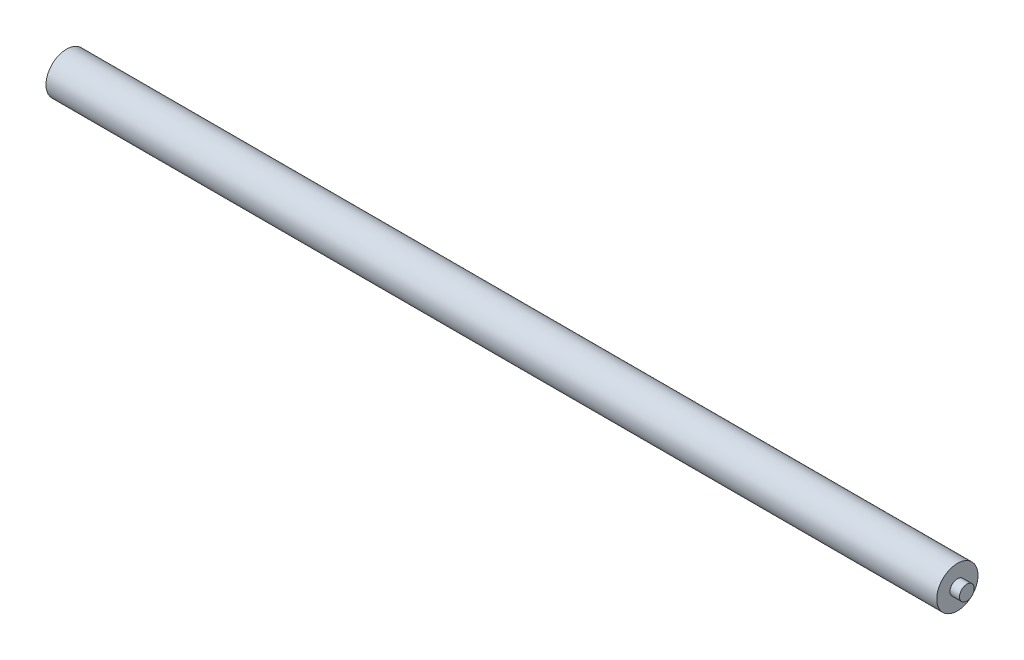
SolidWorks part; units mm, degrees
ref_plane "Front" through (0, 0, 0) normal (0, 0, 1) x (1, 0, 0)
ref_plane "Top" through (0, 0, 0) normal (0, 1, 0) x (1, 0, 0)
ref_plane "Right" through (0, 0, 0) normal (1, 0, 0) x (0, 0, -1)
sketch "Sketch1" plane through (0, 0, 0) normal (0, 0, 1) x (1, 0, 0)
  line L0 (0, 0) -> (-537.2536, 0) construction
  line L1 (-474.6625, 5.08) -> (-474.6625, 11.049)
  line L2 (-474.6625, 11.049) -> (0, 11.049)
  line L3 (0, 11.049) -> (0, 5.08)
  line L4 (-474.6625, 5.08) -> (0, 5.08)
  dimension "D1" = 5.08
  dimension "D2" = 11.049
  dimension "D3" = 474.6625
revolve "Revolve1" add sketch "Sketch1" angle 360 about L0
sketch "Sketch2" plane through (0, 0, 0) normal (1, 0, 0) x (0, 0, -1)
  circle A0 centre (0, 0) radius 3.937
  dimension "D1" = 7.874
extrude "Boss-Extrude1" add sketch "Sketch2" along normal blind 7.62 separate body contours A0
sketch "Sketch3" plane through (0, 0, 0) normal (1, 0, 0) x (0, 0, -1)
  circle A0 centre (0, 0) radius 11.049
extrude "Boss-Extrude2" add sketch "Sketch3" along normal blind 2.54
